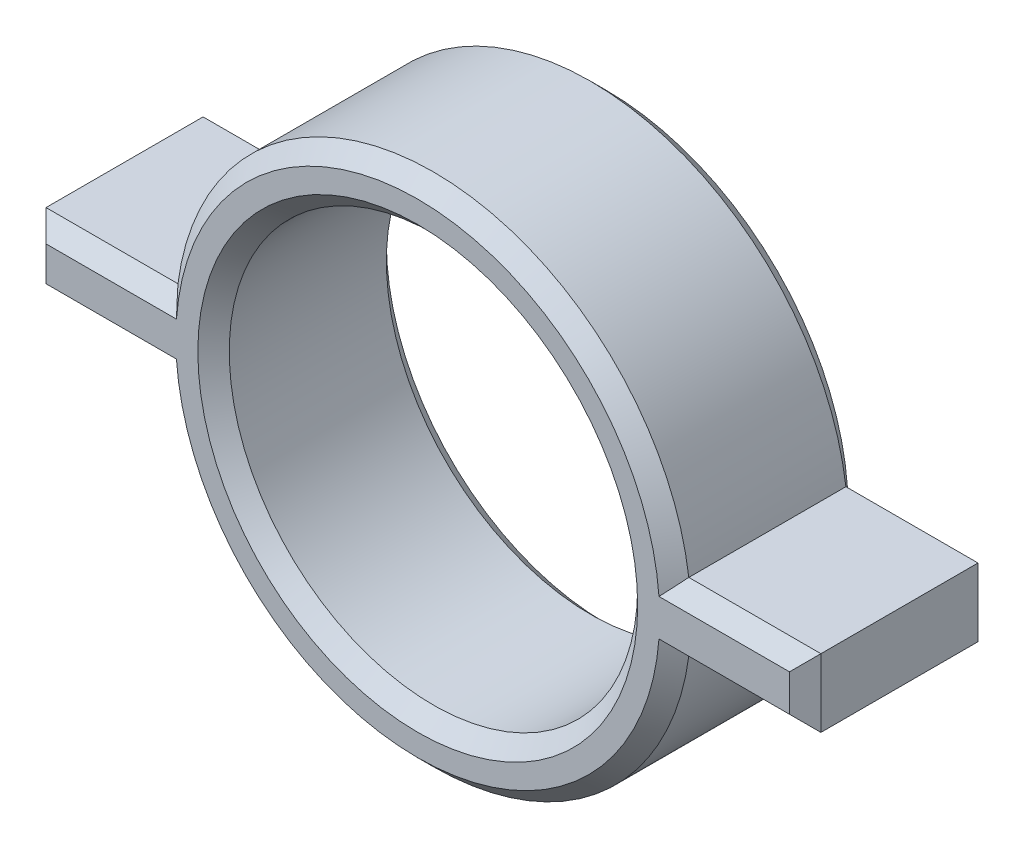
SolidWorks part; units mm, degrees
ref_plane "Front Plane" through (0, 0, 0) normal (0, 0, 1) x (1, 0, 0)
ref_plane "Top Plane" through (0, 0, 0) normal (0, 1, 0) x (1, 0, 0)
ref_plane "Right Plane" through (0, 0, 0) normal (1, 0, 0) x (0, 0, -1)
sketch "Sketch1" plane through (0, 0, 0) normal (0, 0, 1) x (1, 0, 0)
  line L6 (8.1279, -1.0853) -> (12.3325, -1.0853)
  line L7 (12.3325, -1.0853) -> (12.3325, 1.0853)
  line L8 (12.3325, 1.0853) -> (8.1279, 1.0853)
  line L9 (-12.3325, 1.05) -> (-12.3325, -1.05)
  line L10 (-8.1325, 1.05) -> (-12.3325, 1.05)
  line L11 (-12.3325, -1.05) -> (-8.1325, -1.05)
  line L12 (0, 0) -> (16.0081, 0) construction
  line L13 (0, 0) -> (0, -4.3408) construction
  circle A1 centre (0, 0) radius 6.5 construction
  arc A4 (8.1279, 1.0853) -> (-8.1325, 1.05) centre (0, 0) ccw
  arc A5 (-8.1325, -1.05) -> (8.1279, -1.0853) centre (0, 0) ccw
  circle A6 centre (0, 0) radius 6.5
  dimension "D1" = 8.2
  dimension "D2" = 2.1
  dimension "D3" = 4.2
extrude "Boss-Extrude1" add sketch "Sketch1" along normal blind 6
chamfer "Chamfer1" distance 0.5 angle 45 18 edges at (6.5, 0, 0) (-12.3325, 0, 0) (-10.2325, -1.05, 0) (-0.0178, -8.2, 0) (10.2302, -1.0853, 0) (12.3325, 0, 0) (10.2302, 1.0853, 0) (-0.0178, 8.2, 0) (-10.2325, 1.05, 0) (6.5, 0, 6) (-0.0178, 8.2, 6) (10.2302, 1.0853, 6) (12.3325, 0, 6) (10.2302, -1.0853, 6) (-0.0178, -8.2, 6) (-10.2325, -1.05, 6) (-12.3325, 0, 6) (-10.2325, 1.05, 6)
